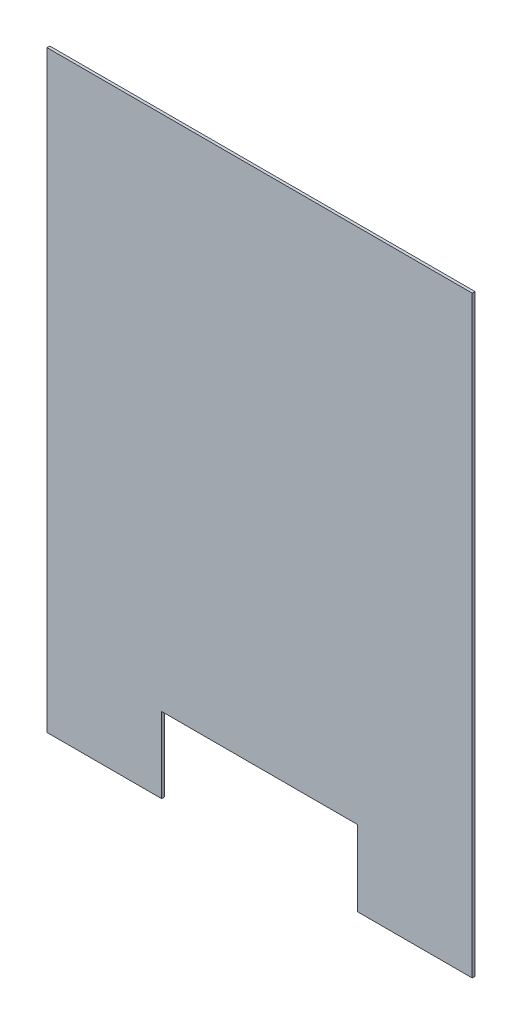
SolidWorks part; units mm, degrees
ref_plane "前视基准面" through (0, 0, 0) normal (0, 0, 1) x (1, 0, 0)
ref_plane "上视基准面" through (0, 0, 0) normal (0, 1, 0) x (1, 0, 0)
ref_plane "右视基准面" through (0, 0, 0) normal (1, 0, 0) x (0, 0, -1)
other "Configuration Table"
sketch "Insulator_ASSUMED_T0_2_Sketch" plane through (0, 0, 0) normal (0, 0, 1) x (1, 0, 0)
  line L1 (-15.2, -21.2) -> (15.2, -21.2)
  line L2 (-15.2, -21.2) -> (-15.2, 21.2)
  line L3 (-15.2, 21.2) -> (15.2, 21.2)
  line L4 (15.2, -21.2) -> (15.2, 21.2)
extrude "Insulator_ASSUMED_T0_2" add sketch "Insulator_ASSUMED_T0_2_Sketch" along normal blind 0.2 from offset 5.6
sketch "FPC_connector_sheet_relief_Sketch" plane through (0, 0, 0) normal (0, 0, 1) x (1, 0, 0)
  line L1 (-7, -22.2) -> (7, -22.2)
  line L2 (-7, -22.2) -> (-7, -15.8)
  line L3 (-7, -15.8) -> (7, -15.8)
  line L4 (7, -22.2) -> (7, -15.8)
extrude "FPC_connector_sheet_relief" cut sketch "FPC_connector_sheet_relief_Sketch" along normal blind 0.22 from offset 5.59
